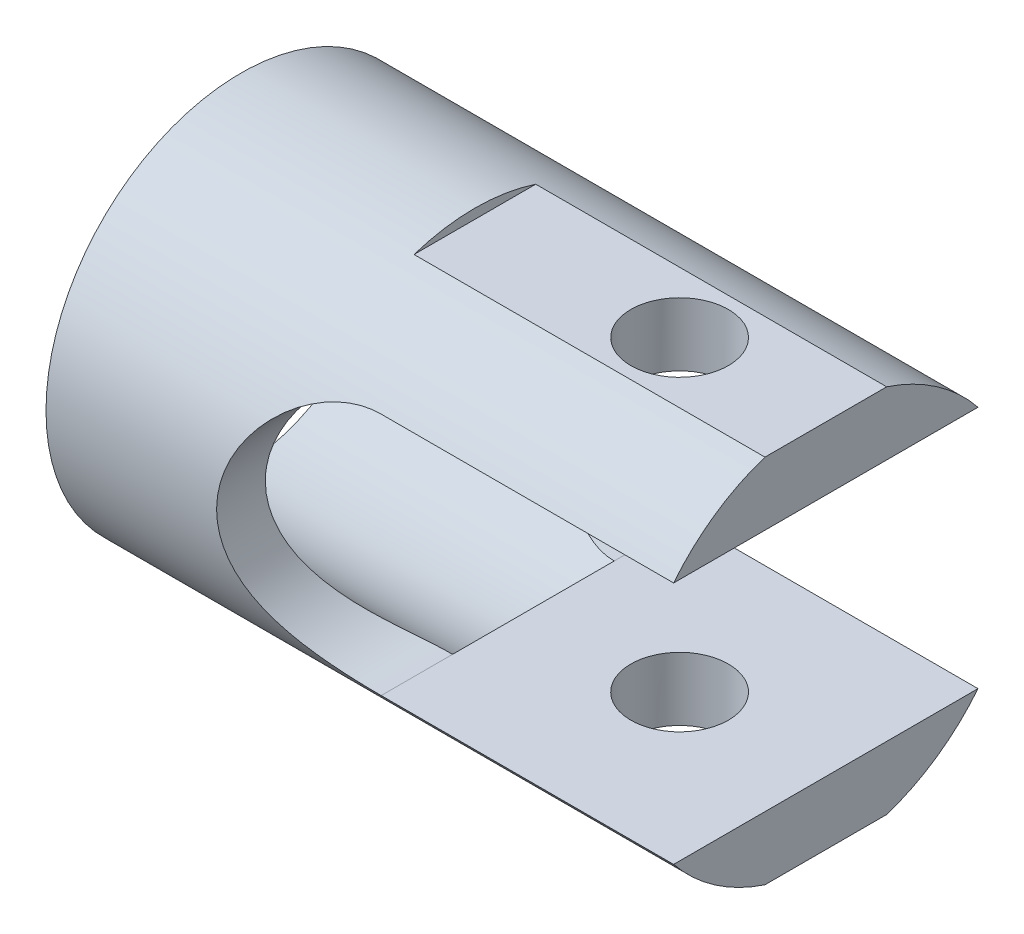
SolidWorks part; units mm, degrees
ref_plane "Front Plane" through (0, 0, 0) normal (0, 0, 1) x (1, 0, 0)
ref_plane "Top Plane" through (0, 0, 0) normal (0, 1, 0) x (1, 0, 0)
ref_plane "Right Plane" through (0, 0, 0) normal (1, 0, 0) x (0, 0, -1)
sketch "Sketch1" plane through (0, 0, 0) normal (0, 0, 1) x (1, 0, 0)
  line L0 (-90.1976, 0) -> (88.6791, 0) construction
  line L2 (0, 12.7) -> (38.1, 12.7)
  line L3 (0, 12.7) -> (0, 9.525)
  line L4 (0, 9.525) -> (19.05, 9.525)
  line L5 (38.1, 12.7) -> (38.1, 9.525)
  line L7 (38.1, 9.525) -> (38.1, 6.35)
  line L8 (38.1, 6.35) -> (19.05, 6.35)
  line L9 (19.05, 9.525) -> (19.05, 6.35)
  dimension "D1" = 9.525
  dimension "D2" = 12.7
  dimension "D3" = 38.1
  dimension "D4" = 6.35
  dimension "D5" = 19.05
revolve "Revolve1" add sketch "Sketch1" angle 360 about L0
sketch "Sketch2" plane through (0, 0, 0) normal (0, 0, 1) x (1, 0, 0)
  line L0 (38.1, -12.7) -> (38.1, 12.7) construction
  line L1 (54.2173, 7.9375) -> (19.05, 7.9375)
  line L2 (54.2173, 7.9375) -> (54.2173, -7.9375)
  line L3 (54.2173, -7.9375) -> (19.05, -7.9375)
  arc A0 (19.05, 7.9375) -> (19.05, -7.9375) centre (19.05, 0) ccw
  dimension "D1" = 7.9375
  dimension "D2" = 19.05
extrude "Cut-Extrude1" cut sketch "Sketch2" against normal through all and the other way through all
sketch "Sketch3" plane through (0, 0, 0) normal (1, 0, 0) x (0, 0, -1)
  line L1 (-12.7, 17.2392) -> (12.7, 17.2392)
  line L2 (-12.7, 17.2392) -> (-12.7, 12.065)
  line L3 (-12.7, 12.065) -> (12.7, 12.065)
  line L4 (12.7, 17.2392) -> (12.7, 12.065)
  line L5 (-12.7, -12.065) -> (12.7, -12.065)
  line L6 (-12.7, -12.065) -> (-12.7, -18.6684)
  line L7 (-12.7, -18.6684) -> (12.7, -18.6684)
  line L8 (12.7, -12.065) -> (12.7, -18.6684)
  dimension "D1" = 25.4
  dimension "D2" = 12.7
  dimension "D3" = 12.7
  dimension "D4" = 25.4
  dimension "D5" = 12.065
  dimension "D6" = 12.065
extrude "Cut-Extrude2" cut sketch "Sketch3" along normal through all from offset 15.24
sketch "Sketch4" plane through (0, 0, 0) normal (0, 1, 0) x (1, 0, 0)
  line L0 (38.1, -3.9656) -> (38.1, 3.9656) construction
  circle A0 centre (28.575, 0) radius 3.175
  dimension "D1" = 6.35
  dimension "D2" = 9.525
extrude "Cut-Extrude3" cut sketch "Sketch4" against normal through all and the other way through all
